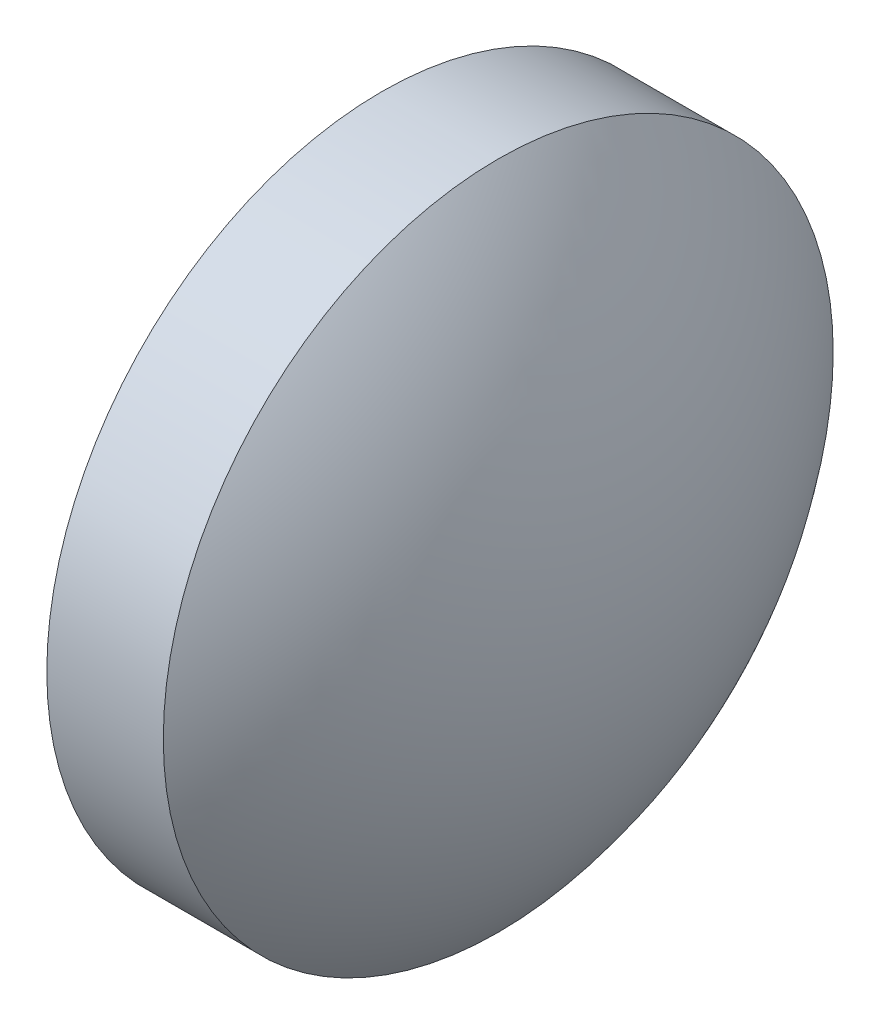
SolidWorks part; units mm, degrees
ref_plane "Vorne" through (0, 0, 0) normal (0, 0, 1) x (1, 0, 0)
ref_plane "Oben" through (0, 0, 0) normal (0, 1, 0) x (1, 0, 0)
ref_plane "Rechts" through (0, 0, 0) normal (1, 0, 0) x (0, 0, -1)
sketch "Skizze1" plane through (0, 0, 0) normal (0, 0, 1) x (1, 0, 0)
  line L0 (0, 0) -> (79.1682, 0) construction
  line L1 (15.383, 3) -> (24.272, 3) construction
  line L2 (15, 0) -> (17.5, 0)
  line L3 (15.383, 3) -> (16.4265, 3)
  arc A1 (15.383, 3) -> (15, 0) centre (26.94, 0) ccw construction
  arc A2 (17.5, 0) -> (16.4265, 3) centre (12.7713, 0) ccw construction
  arc A3 (15.383, 3) -> (15, 0) centre (26.94, 0) ccw
  arc A4 (17.5, 0) -> (16.4265, 3) centre (12.7713, 0) ccw
revolve "Rotation1" add sketch "Skizze1" angle 360 about L2
